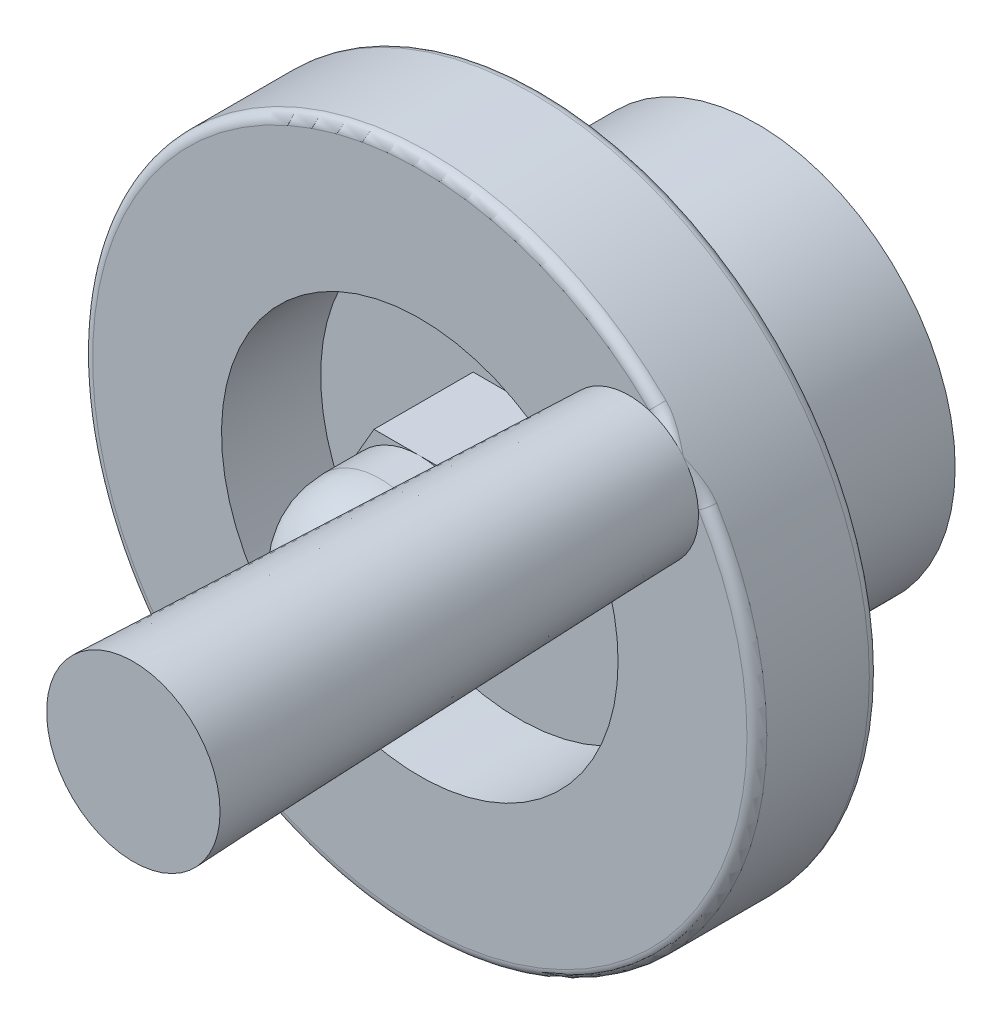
SolidWorks part; units mm, degrees
ref_plane "Piano frontale" through (0, 0, 0) normal (0, 0, 1) x (1, 0, 0)
ref_plane "Piano superiore" through (0, 0, 0) normal (0, 1, 0) x (1, 0, 0)
ref_plane "Piano destro" through (0, 0, 0) normal (1, 0, 0) x (0, 0, -1)
sketch "Schizzo1" plane through (0, 0, 0) normal (0, 0, 1) x (1, 0, 0)
  circle A0 centre (0, 0) radius 10
  dimension "D1" = 20
extrude "Estrusione-Estrusione1" add sketch "Schizzo1" along normal blind 8
sketch "Schizzo3" plane through (0, 0, 0) normal (1, 0, 0) x (0, 0, -1)
  line L0 (-8, 0) -> (-8, 10)
  line L1 (-8, 10) -> (-8, -10) construction
  line L2 (-8, 10) -> (-11, 17)
  line L3 (-11, 17) -> (-11, 0)
  line L4 (-11, 0) -> (-8, 0)
revolve "Rivoluzione1" add sketch "Schizzo3" angle 360 about L4
sketch "Schizzo4" plane through (0, 0, 11) normal (0, 0, 1) x (1, 0, 0)
  circle A0 centre (0, 0) radius 17
  dimension "D1" = 34
extrude "Estrusione-Estrusione3" add sketch "Schizzo4" along normal blind 6
sketch "Schizzo5" plane through (0, 0, 17) normal (0, 0, 1) x (1, 0, 0)
  circle A0 centre (0, 0) radius 10
extrude "Taglio-Estrusione1" cut sketch "Schizzo5" against normal blind 5
sketch "Schizzo6" plane through (0, 0, 12) normal (0, 0, 1) x (1, 0, 0)
  line L1 (4.6188, 0) -> (2.3094, 4)
  line L2 (2.3094, 4) -> (-2.3094, 4)
  line L3 (-2.3094, 4) -> (-4.6188, 0)
  line L4 (-4.6188, 0) -> (-2.3094, -4)
  line L5 (-2.3094, -4) -> (2.3094, -4)
  line L6 (2.3094, -4) -> (4.6188, 0)
  circle A0 centre (0, 0) radius 4 construction
extrude "Estrusione-Estrusione4" add sketch "Schizzo6" along normal blind 5
sketch "Schizzo7" plane through (0, 0, 17) normal (0, 0, 1) x (1, 0, 0)
  circle A0 centre (0, 0) radius 4
extrude "Estrusione-Estrusione5" add sketch "Schizzo7" along normal blind 2
sketch "Schizzo8" plane through (0, 0, 19) normal (0, 0, 1) x (1, 0, 0)
  line L0 (0, 4) -> (0, -4)
  arc A0 (0, -4) -> (0, 4) centre (0, 0) ccw
  dimension "D1" = 8
revolve "Rivoluzione2" add sketch "Schizzo8" angle 180 about L0
fillet "Raccordo1" radius 0.5 1 edges at (10, 0, 8)
fillet "Raccordo2" radius 0.5 1 edges at (17, 0, 11)
sketch "Schizzo9" plane through (0, 0, 17) normal (0, 0, 1) x (1, 0, 0)
  circle A0 centre (10.5547, 8.4172) radius 3.5
  circle A1 centre (0, 0) radius 17 construction
extrude "Estrusione-Estrusione6" add sketch "Schizzo9" along normal blind 25 draft 2
fillet "Raccordo3" radius 0.5 1 edges at (17, 0, 17)
equation "\"D1@Schizzo3\"=34/2"
equation "\"D1@Schizzo5\"=34-7*2"
equation "\"D2@Schizzo9\"=34/2-7/2"
